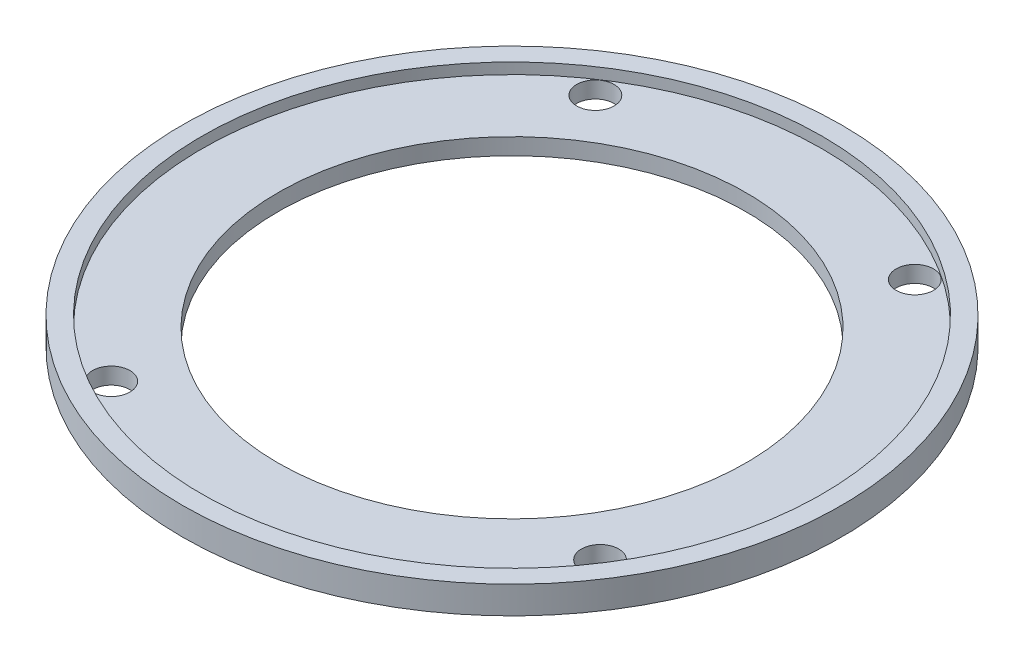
SolidWorks part; units mm, degrees
ref_plane "Front Plane" through (0, 0, 0) normal (0, 0, 1) x (1, 0, 0)
ref_plane "Top Plane" through (0, 0, 0) normal (0, 1, 0) x (1, 0, 0)
ref_plane "Right Plane" through (0, 0, 0) normal (1, 0, 0) x (0, 0, -1)
sketch "Sketch1" plane through (0, 0, 0) normal (0, 1, 0) x (1, 0, 0)
  circle A0 centre (0, 0) radius 29.337
  circle A1 centre (0, 0) radius 22.2821
  dimension "D1" = 58.674
  dimension "D2" = 44.5643
extrude "Boss-Extrude1" add sketch "Sketch1" along normal blind 1.5748
sketch "Sketch2" plane through (0, 0, 0) normal (0, -1, 0) x (1, 0, 0)
  line L0 (23.3144, 14.9317) -> (-14.6594, 23.4865) construction
  line L1 (23.3144, 14.9317) -> (15.2019, -23.1391) construction
  line L2 (15.2019, -23.1391) -> (-15.2019, -23.1391) construction
  circle A0 centre (23.3144, 14.9317) radius 1.651
  circle A1 centre (15.2019, -23.1391) radius 1.651
  circle A2 centre (-15.2019, -23.1391) radius 1.651
  circle A3 centre (-14.6594, 23.4865) radius 1.651
  circle A4 centre (0, 0) radius 29.337 construction
  circle A5 centre (-14.6594, 23.4865) radius 0.762
  circle A6 centre (23.3144, 14.9317) radius 0.762
  circle A7 centre (-15.2019, -23.1391) radius 0.762
  circle A8 centre (15.2019, -23.1391) radius 0.762
  dimension "D1" = 3.302
  dimension "D4" = 1.524
  dimension "D2" = 38.9255
  dimension "D3" = 30.4038
extrude "Boss-Extrude2" add sketch "Sketch2" along normal blind 6.5024
sketch "Sketch4" plane through (0, 0, 0) normal (0, -1, 0) x (1, 0, 0)
  circle A0 centre (0, 0) radius 31.369
  circle A1 centre (0, 0) radius 29.337 construction
  circle A2 centre (0, 0) radius 29.337
  dimension "D1" = 62.738
extrude "Boss-Extrude3" add sketch "Sketch4" against normal up to surface (1.5748 mm away)
sketch "Sketch5" plane through (0, -6.5024, 0) normal (0, -1, 0) x (1, 0, 0)
  circle A0 centre (-14.6594, 23.4865) radius 1.778
  circle A1 centre (23.3144, 14.9317) radius 1.778
  circle A2 centre (15.2019, -23.1391) radius 1.778
  circle A3 centre (-15.2019, -23.1391) radius 1.778
  dimension "D1" = 3.556
extrude "Cut-Extrude2" cut sketch "Sketch5" against normal through all
sketch "Sketch6" plane through (0, 1.5748, 0) normal (0, 1, 0) x (1, 0, 0)
  circle A0 centre (0, 0) radius 31.369 construction
  circle A1 centre (0, 0) radius 31.369
  circle A2 centre (0, 0) radius 29.5148
  dimension "D1" = 1.8542
extrude "Boss-Extrude4" add sketch "Sketch6" along normal offset from surface (1.0414 mm away) 2.6162
